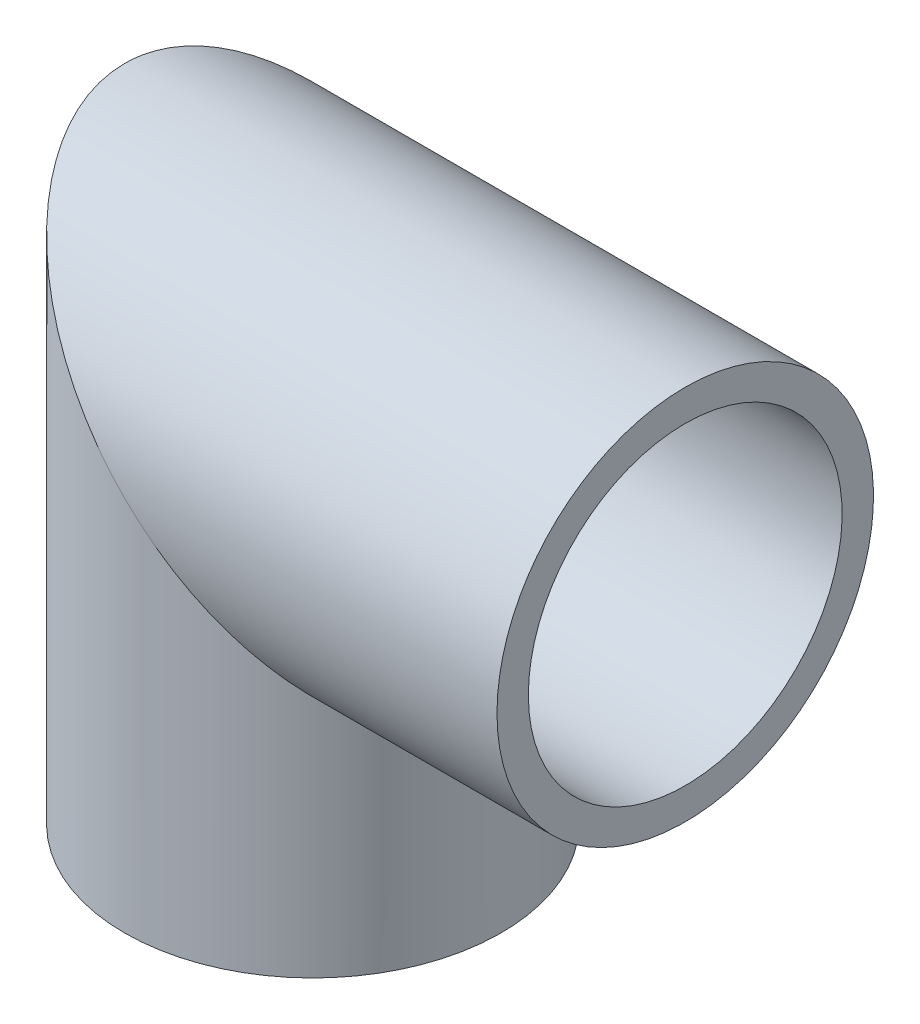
SolidWorks part; units mm, degrees
ref_plane "Alzado" through (0, 0, 0) normal (0, 0, 1) x (1, 0, 0)
ref_plane "Planta" through (0, 0, 0) normal (0, 1, 0) x (1, 0, 0)
ref_plane "Vista lateral" through (0, 0, 0) normal (1, 0, 0) x (0, 0, -1)
sketch "Croquis1" plane through (0, 0, 0) normal (0, 1, 0) x (1, 0, 0)
  circle A0 centre (0, 0) radius 6
  circle A1 centre (0, 0) radius 5
  dimension "D1" = 12
  dimension "D2" = 10
sketch "Croquis2" plane through (0, 0, 0) normal (0, 0, 1) x (1, 0, 0)
  line L0 (0, 0) -> (0, 12)
  line L1 (0, 12) -> (11.87, 12)
  dimension "D1" = 12
  dimension "D2" = 11.87
sweep "Barrer1" add profiles "Croquis1" path "Croquis2"
